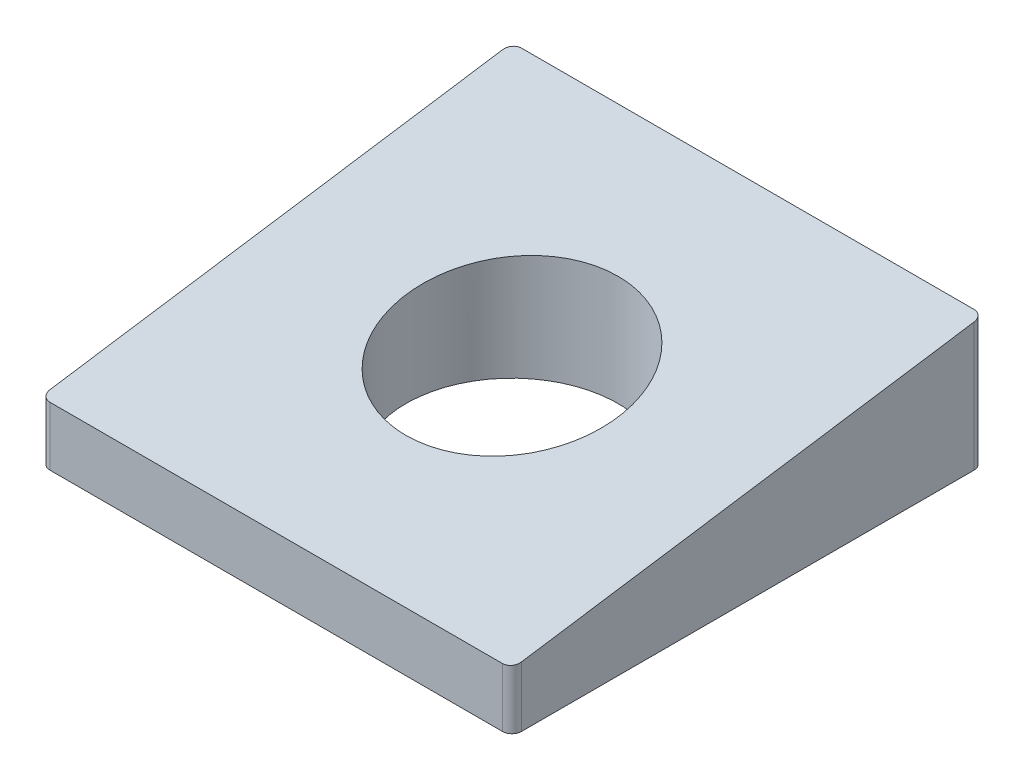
SolidWorks part; units mm, degrees
ref_plane "Front Plane" through (0, 0, 0) normal (0, 0, 1) x (1, 0, 0)
ref_plane "Top Plane" through (0, 0, 0) normal (0, 1, 0) x (1, 0, 0)
ref_plane "Right Plane" through (0, 0, 0) normal (1, 0, 0) x (0, 0, -1)
sketch "Sketch1" plane through (0, 0, 0) normal (-1, 0, 0) x (0, 0, 1)
  line L0 (-15.875, -4.3688) -> (15.875, -4.3688) construction
  line L1 (15.875, -4.3688) -> (15.875, -0.4064) construction
  line L2 (15.875, -0.4064) -> (-15.875, 4.3688) construction
  line L3 (-15.875, 4.3688) -> (-15.875, -4.3688) construction
  line L4 (0, -4.3688) -> (0, 4.3688) construction
  point P5 (0, 0)
sketch "Sketch2" plane through (0, 0, 0) normal (0, 1, 0) x (1, 0, 0)
  line L0 (-15.875, -15.875) -> (15.875, 15.875) construction
  line L1 (-15.875, 15.875) -> (15.875, 15.875) construction
  line L2 (-15.875, 15.875) -> (-15.875, -15.875) construction
  line L3 (-15.875, -15.875) -> (15.875, -15.875) construction
  line L4 (15.875, 15.875) -> (15.875, -15.875) construction
  line L5 (15.875, -15.875) -> (-15.875, 15.875) construction
  line L6 (0, 15.875) -> (0, -15.875) construction
  line L7 (-7.1374, 0) -> (7.1374, 0) construction
  circle A0 centre (0, 0) radius 7.1374 construction
  point P4 (0, 0)
  dimension "ID" = 14.2748
sketch "Sketch3" plane through (0, 0, 0) normal (1, 0, 0) x (0, 0, -1)
  line L0 (-15.875, -0.4064) -> (15.875, 4.3688)
  line L1 (15.875, 4.3688) -> (15.875, -4.3688)
  line L2 (15.875, -4.3688) -> (-15.875, -4.3688)
  line L3 (-15.875, -4.3688) -> (-15.875, -0.4064)
  line L4 (-15.875, -4.3688) -> (-15.875, -0.4064) construction
extrude "Boss-Extrude1" add sketch "Sketch3" against normal up to vertex (15.875 mm away) and the other way up to vertex (15.875 mm away)
sketch "Sketch4" plane through (0, 0, 0) normal (0, 1, 0) x (1, 0, 0)
  circle A0 centre (0, 0) radius 7.1374
  circle A1 centre (0, 0) radius 7.1374 construction
extrude "Cut-Extrude1" cut sketch "Sketch4" against normal through all both and the other way through all
fillet "Fillet1" radius 0.635 4 edges at (-15.875, -2.3876, 15.875) (-15.875, 0, -15.875) (15.875, 0, -15.875) (15.875, -2.3876, 15.875)
equation "\"D1@Fillet1\"=\"Width@Sketch1\"*.02"
